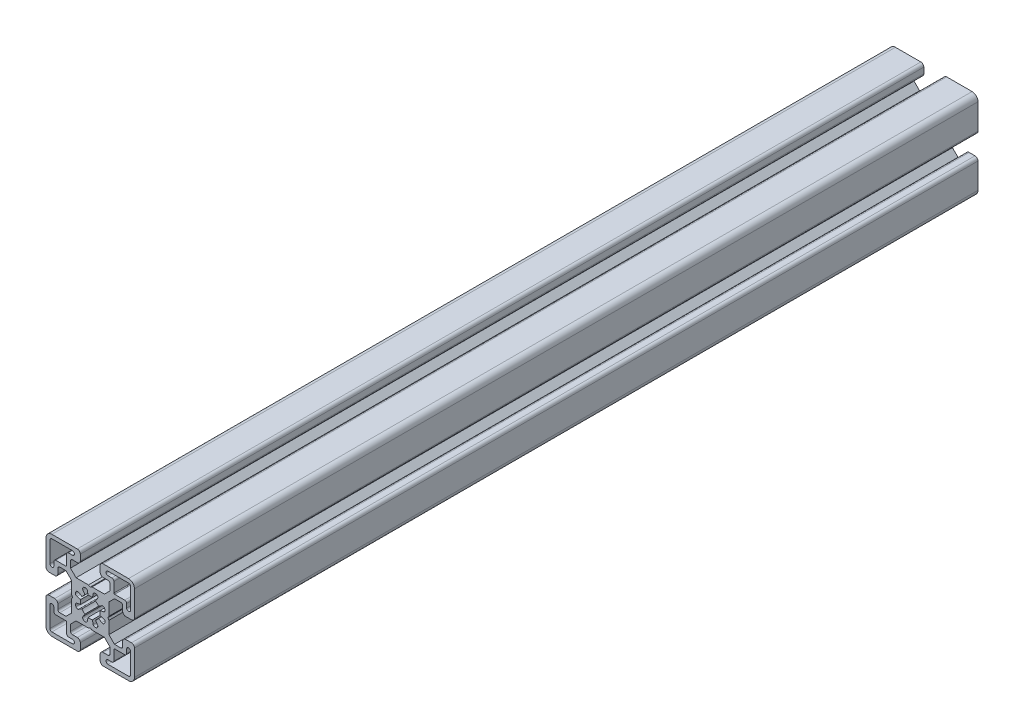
SolidWorks part; units mm, degrees
ref_plane "Front Plane" through (0, 0, 0) normal (0, 0, 1) x (1, 0, 0)
ref_plane "Top Plane" through (0, 0, 0) normal (0, 1, 0) x (1, 0, 0)
ref_plane "Right Plane" through (0, 0, 0) normal (1, 0, 0) x (0, 0, -1)
ref_plane "RIGHT" through (0, 0, 0) normal (1, 0, 0) x (0, 1, 0)
ref_plane "TOP" through (0, 0, 0) normal (0, 1, 0) x (0, 0, 1)
ref_plane "FRONT" through (0, 0, 0) normal (0, 0, 1) x (1, 0, 0)
imported_body "Imported1"
sketch "Sketch2" plane through (0, 0, -3048) normal (0, 0, -1) x (-1, 0, 0)
  line L1 (24.42, -24.4734) -> (-24.796, -24.4734)
  line L2 (24.42, -24.4734) -> (24.42, 24.7426)
  line L3 (24.42, 24.7426) -> (-24.796, 24.7426)
  line L4 (-24.796, -24.4734) -> (-24.796, 24.7426)
extrude "Cut-Extrude1" cut sketch "Sketch2" against normal blind 2618.994
